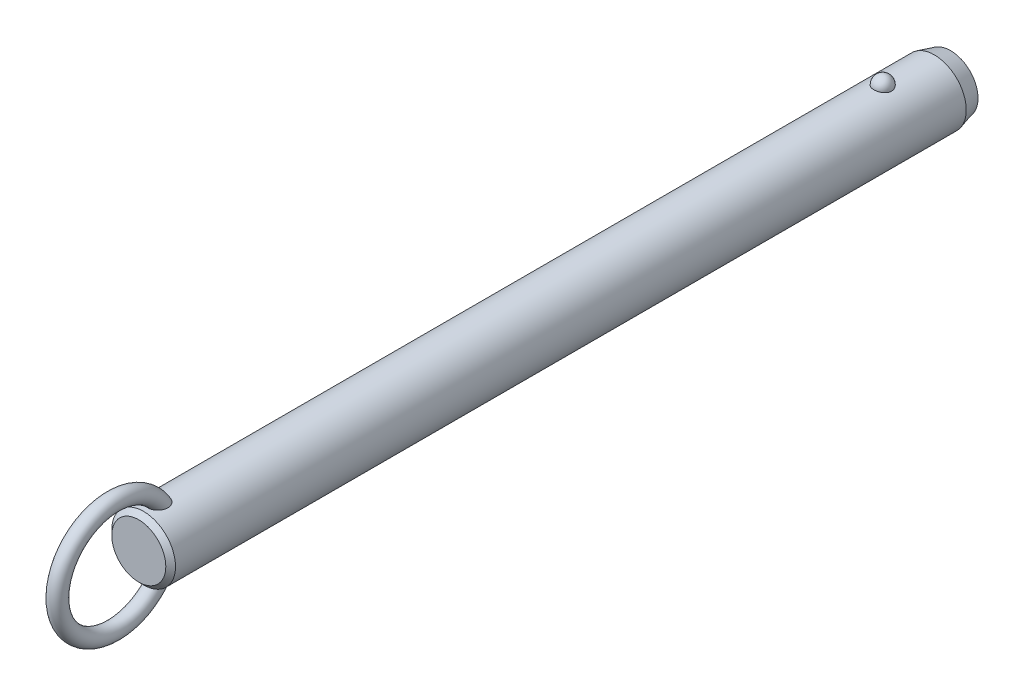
SolidWorks part; units mm, degrees
ref_plane "Front Plane" through (0, 0, 0) normal (0, 0, 1) x (1, 0, 0)
ref_plane "Top Plane" through (0, 0, 0) normal (0, 1, 0) x (1, 0, 0)
ref_plane "Right Plane" through (0, 0, 0) normal (1, 0, 0) x (0, 0, -1)
sketch "Sketch2" plane through (0, 0, 0) normal (0, 0, 1) x (1, 0, 0)
  circle A0 centre (0, 0) radius 7.9
  point P3 (0, 7.9)
  dimension "D1" = 15.8
extrude "Boss-Extrude1" add sketch "Sketch2" along normal blind 172.7
sketch "Sketch3" plane through (0, 0, 0) normal (0, 0, -1) x (-1, 0, 0)
  circle A0 centre (0, 0) radius 7.9
  dimension "D1" = 15.8
extrude "Boss-Extrude2" add sketch "Sketch3" along normal blind 19
chamfer "Chamfer1" distance 4 angle 15 1 edges at (-7.9, 0, -19)
sketch "Sketch12" plane through (0, 0, 0) normal (1, 0, 0) x (0, 0, -1)
  line L0 (-172.7, 7.9) -> (-172.7, -7.9) construction
  point P0 (-172.7, 0)
sketch "Sketch13" plane through (0, 0, 0) normal (1, 0, 0) x (0, 0, -1)
  circle A0 centre (-188.55, 0) radius 15.85
  point P2 (-172.7, 0)
  dimension "D1" = 31.7
sketch "Sketch14" plane through (0, 0, 0) normal (0, 1, 0) x (1, 0, 0)
  circle A0 centre (0, -174.7) radius 2
  point P2 (0, -172.7)
  dimension "D1" = 4
sweep "Sweep1" add profiles "Sketch14" path "Sketch13"
sketch "Sketch15" plane through (0, 0, 172.7) normal (0, 0, 1) x (1, 0, 0)
  circle A0 centre (0, 0) radius 7.9
  dimension "D1" = 15.8
extrude "Boss-Extrude3" add sketch "Sketch15" along normal blind 9.52
chamfer "Chamfer2" distance 1.2 angle 45 1 edges at (7.9, 0, 182.22)
sketch "Sketch18" plane through (0, 0, 0) normal (1, 0, 0) x (0, 0, -1)
  line L0 (15, 7.9) -> (-174.8091, 7.9) construction
  line L1 (2.2, 10.1) -> (2.2, 5.7)
  line L2 (-174.8091, -7.9) -> (15, -7.9) construction
  arc A0 (2.2, 10.1) -> (2.2, 5.7) centre (2.2, 7.9) ccw
  point P4 (0, 7.9)
  dimension "D1" = 18
revolve "Revolve1" add sketch "Sketch18" angle 360 about L1
